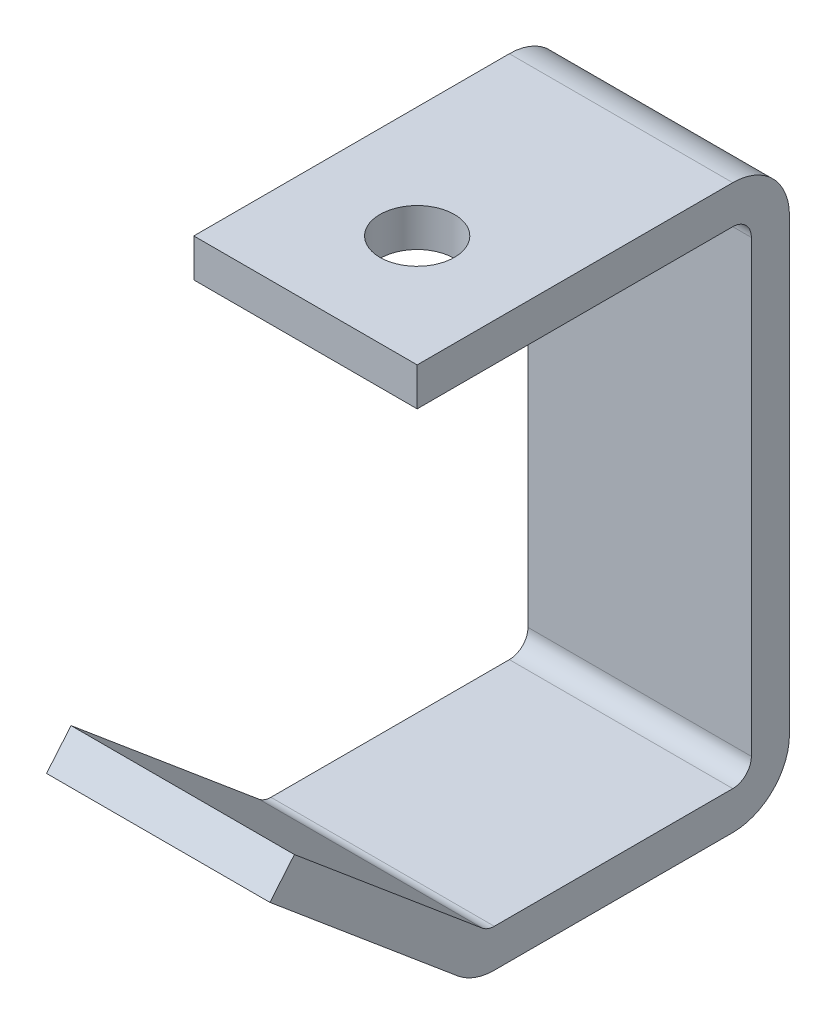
SolidWorks part; units mm, degrees
ref_plane "front" through (0, 0, 0) normal (0, 0, 1) x (1, 0, 0)
ref_plane "top" through (0, 0, 0) normal (0, 1, 0) x (1, 0, 0)
ref_plane "right" through (0, 0, 0) normal (1, 0, 0) x (0, 0, -1)
sketch "Sketch1" plane through (0, 0, 0) normal (1, 0, 0) x (0, 0, -1)
  line L0 (0, 0) -> (0, 83)
  line L1 (0, 83) -> (-57, 83)
  line L4 (-77.9399, 27.6399) -> (-45, 0)
  line L5 (-45, 0) -> (0, 0)
  dimension "D1" = 83
  dimension "D2" = 57
  dimension "D3" = 40
  dimension "D4" = 43
  dimension "D5" = 45
extrude "Base-Extrude-Thin" add sketch "Sketch1" along normal mid plane 38.1 thin
sketch "Sketch2" plane through (0, 89.5, 0) normal (0, 1, 0) x (-1, 0, 0)
  line L0 (0, 50) -> (0, -50) construction
  line L1 (-19.05, 57) -> (19.05, 57) construction
  circle A0 centre (0, 37.95) radius 6.35
  dimension "D1" = 12.7
  dimension "D2" = 19.05
extrude "Cut-Extrude1" cut sketch "Sketch2" against normal up to next
